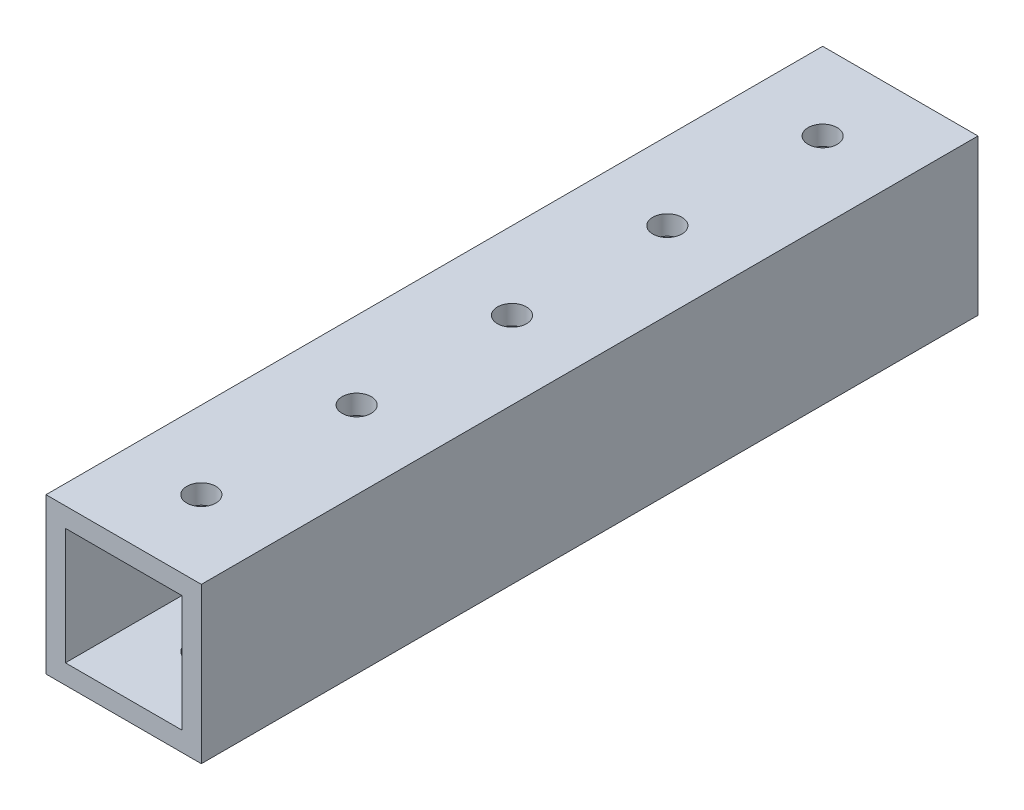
SolidWorks part; units mm, degrees
ref_plane "Front" through (0, 0, 0) normal (0, 0, 1) x (1, 0, 0)
ref_plane "Top" through (0, 0, 0) normal (0, 1, 0) x (1, 0, 0)
ref_plane "Right" through (0, 0, 0) normal (1, 0, 0) x (0, 0, -1)
sketch "Sketch1" plane through (0, 0, 0) normal (0, 0, 1) x (1, 0, 0)
  line L0 (-9.525, 9.525) -> (-9.525, -9.525)
  line L1 (-12.7, 12.7) -> (12.7, 12.7)
  line L2 (-12.7, 12.7) -> (-12.7, -12.7)
  line L3 (-12.7, -12.7) -> (12.7, -12.7)
  line L4 (12.7, 12.7) -> (12.7, -12.7)
  line L5 (-12.7, 12.7) -> (12.7, -12.7) construction
  line L6 (-12.7, -12.7) -> (12.7, 12.7) construction
  line L7 (-9.525, -9.525) -> (9.525, -9.525)
  line L8 (9.525, 9.525) -> (9.525, -9.525)
  line L9 (-9.525, 9.525) -> (9.525, 9.525)
  point P0 (0, 0)
  dimension "D1" = 25.4
  dimension "D2" = 25.4
  dimension "D3" = 3.175
extrude "Boss-Extrude1" add sketch "Sketch1" along normal mid plane 127 contours L0 L7 L8 L9 | L4 L3 L2 L1
sketch "Sketch2" plane through (0, 12.7, 0) normal (0, 1, 0) x (1, 0, 0)
  line L0 (0, 80.885) -> (0, -82.8666) construction
  line L1 (-12.7, 63.5) -> (12.7, 63.5) construction
  circle A0 centre (0, 50.8) radius 2.3812
  dimension "D2" = 4.7625
  dimension "D1" = 12.7
extrude "Cut-Extrude1" cut sketch "Sketch2" against normal through all
pattern_linear "LPattern1" count 6 spacing 25.4 along (0, 0, 1) of "Cut-Extrude1"
